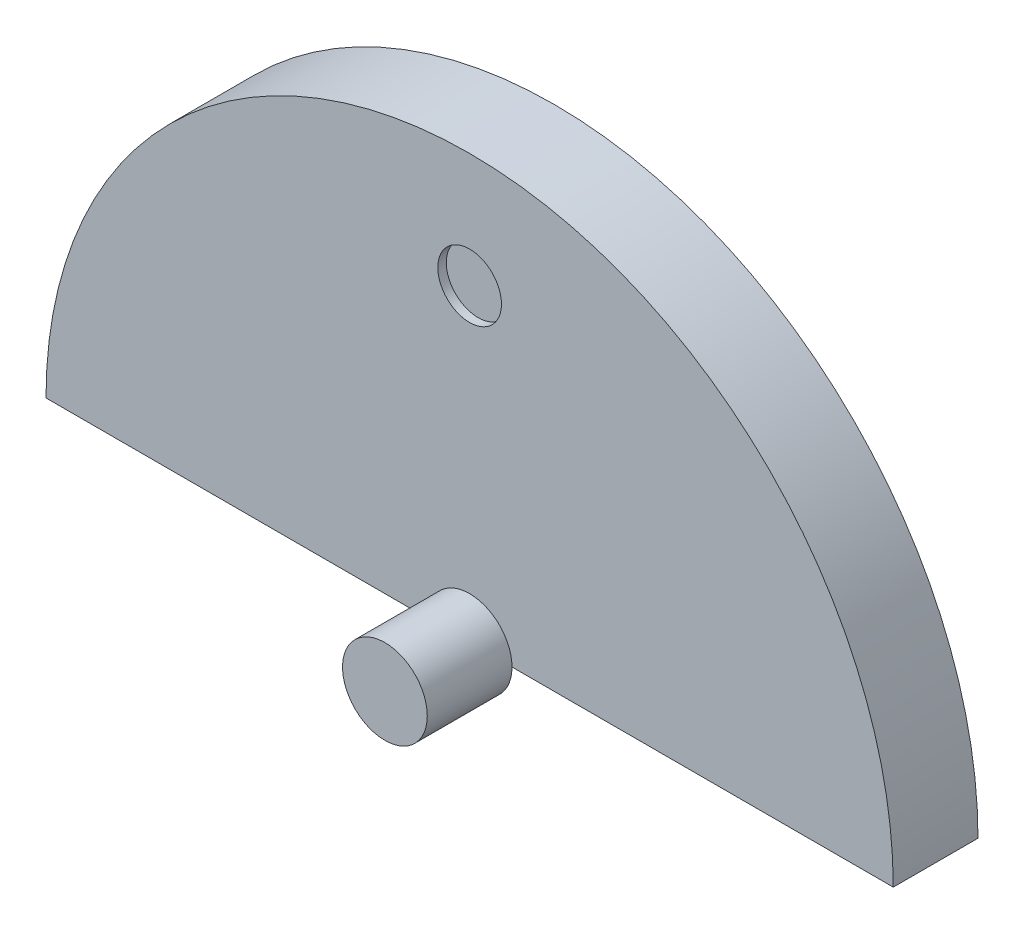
SolidWorks part; units mm, degrees
ref_plane "Plan de face" through (0, 0, 0) normal (0, 0, 1) x (1, 0, 0)
ref_plane "Plan de dessus" through (0, 0, 0) normal (0, 1, 0) x (1, 0, 0)
ref_plane "Plan de droite" through (0, 0, 0) normal (1, 0, 0) x (0, 0, -1)
sketch "Esquisse1" plane through (0, 0, 0) normal (0, 0, 1) x (1, 0, 0)
  line L0 (-500, 0) -> (500, 0)
  arc A0 (500, 0) -> (-500, 0) centre (0, 0) ccw
  dimension "D1" = 1000
extrude "Boss.-Extru.1" add sketch "Esquisse1" along normal blind 100
sketch "Esquisse4" plane through (0, 0, 100) normal (0, 0, 1) x (1, 0, 0)
  circle A0 centre (0, 0) radius 50
  dimension "D1" = 100
extrude "Boss.-Extru.2" add sketch "Esquisse4" along normal blind 100
sketch "Esquisse5" plane through (0, 0, 100) normal (0, 0, 1) x (1, 0, 0)
  circle A0 centre (0, 364.6794) radius 37.559
extrude "Enlèv. mat.-Extru.1" cut sketch "Esquisse5" against normal blind 10
